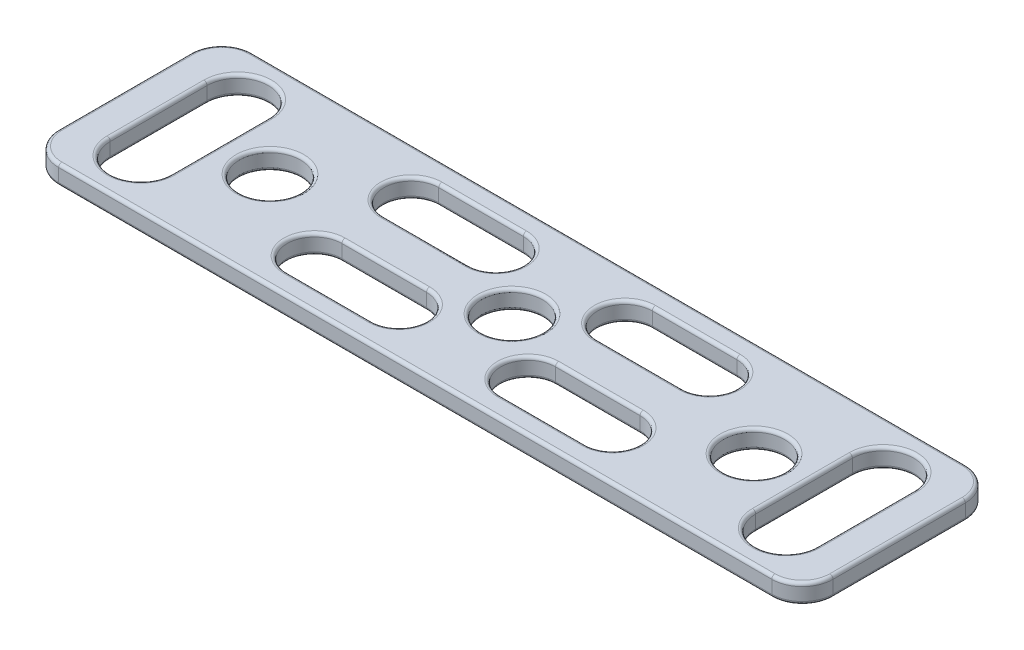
SolidWorks part; units mm, degrees
ref_plane "Front" through (0, 0, 0) normal (0, 0, 1) x (1, 0, 0)
ref_plane "Top" through (0, 0, 0) normal (0, 1, 0) x (1, 0, 0)
ref_plane "Right" through (0, 0, 0) normal (1, 0, 0) x (0, 0, -1)
sketch "Sketch1" plane through (0, 0, 0) normal (0, 1, 0) x (1, 0, 0)
  line L1 (2.413, 0) -> (58.547, 0)
  line L2 (0, 2.413) -> (0, 12.827)
  line L3 (2.413, 15.24) -> (58.547, 15.24)
  line L4 (60.96, 2.413) -> (60.96, 12.827)
  arc A0 (0, 12.827) -> (2.413, 15.24) centre (2.413, 12.827) cw
  arc A1 (2.413, 0) -> (0, 2.413) centre (2.413, 2.413) cw
  arc A2 (58.547, 15.24) -> (60.96, 12.827) centre (58.547, 12.827) cw
  arc A3 (58.547, 0) -> (60.96, 2.413) centre (58.547, 2.413) ccw
  point P6 (0, 15.24)
  point P9 (0, 0)
  point P12 (60.96, 15.24)
  dimension "D3" = 2.413
  dimension "D1" = 60.96
  dimension "D2" = 15.24
extrude "Extrude1" add sketch "Sketch1" along normal blind 1.524
sketch "Sketch2" plane through (0, 1.524, 0) normal (0, 1, 0) x (-1, 0, 0)
  line L0 (-2.413, 0) -> (-58.547, 0) construction
  line L1 (-18.7452, -5.969) -> (-25.4, -5.969)
  line L3 (-18.7452, -1.651) -> (-25.4, -1.651)
  arc A0 (-25.4, -1.651) -> (-25.4, -5.969) centre (-25.4, -3.81) ccw
  arc A1 (-18.7452, -5.969) -> (-18.7452, -1.651) centre (-18.7452, -3.81) ccw
  point P4 (0, 0)
  dimension "D1" = 6.6548
  dimension "D2" = 25.4
  dimension "D3" = 4.318
  dimension "D4" = 3.81
extrude "Cut-Extrude1" cut sketch "Sketch2" against normal through all
sketch "Sketch3" plane through (0, 1.524, 0) normal (0, 1, 0) x (-1, 0, 0)
  line L0 (0, -12.827) -> (0, -2.413) construction
  line L2 (-2.667, -11.43) -> (-2.667, -3.81)
  line L4 (-7.493, -11.43) -> (-7.493, -3.81)
  arc A0 (-7.493, -11.43) -> (-2.667, -11.43) centre (-5.08, -11.43) ccw
  arc A1 (-2.667, -3.81) -> (-7.493, -3.81) centre (-5.08, -3.81) ccw
  dimension "D1" = 7.62
  dimension "D2" = 3.81
  dimension "D3" = 4.826
  dimension "D4" = 5.08
extrude "Cut-Extrude2" cut sketch "Sketch3" against normal through all
sketch "Sketch4" plane through (0, 1.524, 0) normal (0, 1, 0) x (-1, 0, 0)
  line L0 (0, -12.827) -> (0, -2.413) construction
  line L1 (-2.413, 0) -> (-58.547, 0) construction
  circle A0 centre (-30.48, -7.62) radius 2.413
  dimension "D1" = 4.826
  dimension "D2" = 30.48
  dimension "D3" = 7.62
extrude "Cut-Extrude3" cut sketch "Sketch4" against normal through all
ref_plane "Plane1" through (0, 0, -7.62) normal (0, 0, 1) x (1, 0, 0)
ref_plane "Plane2" through (30.48, 0, 0) normal (1, 0, 0) x (0, 0, -1)
mirror "Mirror1" about plane through (0, 0, -7.62) normal (0, 0, 1) of "Cut-Extrude1"
mirror "Mirror2" about plane through (30.48, 0, 0) normal (1, 0, 0) of "Cut-Extrude2", "Mirror1", "Cut-Extrude1"
pattern_linear "LPattern1" count 2 spacing 19.05 along (1, 0, 0) count 2 spacing 19.05 along (-1, 0, 0) of "Cut-Extrude3"
fillet "Fillet1" radius 0.254 70 edges at (0.7068, 1.524, -0.7068) (44.3738, 1.524, -3.81) (38.8874, 1.524, -1.651) (33.401, 1.524, -3.81) (38.8874, 1.524, -5.969) (44.3738, 0, -3.81) (38.8874, 0, -1.651) (33.401, 0, -3.81) (38.8874, 0, -5.969) (11.43, 0, -5.207) (11.43, 1.524, -5.207) (49.53, 0, -5.207) (49.53, 1.524, -5.207) (30.48, 1.524, 0) (60.2532, 1.524, -0.7068) (60.96, 1.524, -7.62) (60.2532, 1.524, -14.5332) (30.48, 1.524, -15.24) (16.5862, 0, -3.81) (22.0726, 0, -5.969) (27.559, 0, -3.81) (22.0726, 0, -1.651) (16.5862, 1.524, -3.81) (22.0726, 1.524, -1.651) (27.559, 1.524, -3.81) (22.0726, 1.524, -5.969) (0.7068, 1.524, -14.5332) (5.08, 0, -13.843) (7.493, 0, -7.62) (5.08, 0, -1.397) (2.667, 0, -7.62) (5.08, 1.524, -13.843) (2.667, 1.524, -7.62) (5.08, 1.524, -1.397) (7.493, 1.524, -7.62) (30.48, 0, -5.207) (30.48, 1.524, -5.207) (16.5862, 1.524, -11.43) (22.0726, 1.524, -13.589) (27.559, 1.524, -11.43) (22.0726, 1.524, -9.271) (16.5862, 0, -11.43) (22.0726, 0, -13.589) (27.559, 0, -11.43) (22.0726, 0, -9.271) (30.48, 0, -15.24) (0, 1.524, -7.62) (60.2532, 0, -14.5332) (60.96, 0, -7.62) (55.88, 1.524, -13.843) (58.293, 1.524, -7.62) (55.88, 1.524, -1.397) (53.467, 1.524, -7.62) (55.88, 0, -13.843) (58.293, 0, -7.62) (55.88, 0, -1.397) (53.467, 0, -7.62) (60.2532, 0, -0.7068) (30.48, 0, 0) (0.7068, 0, -0.7068) (44.3738, 0, -11.43) (38.8874, 0, -9.271) (33.401, 0, -11.43) (38.8874, 0, -13.589) (44.3738, 1.524, -11.43) (38.8874, 1.524, -13.589) (0, 0, -7.62) (33.401, 1.524, -11.43) (38.8874, 1.524, -9.271) (0.7068, 0, -14.5332)
